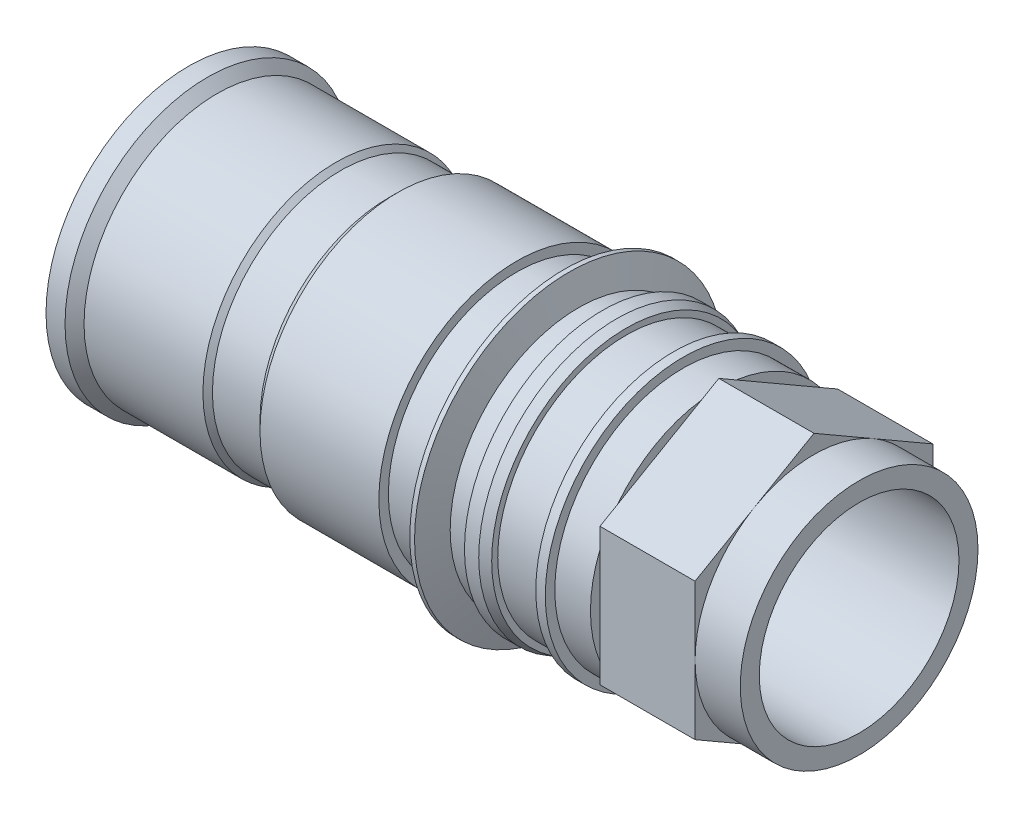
SolidWorks part; units mm, degrees
ref_plane "Alzado" through (0, 0, 0) normal (0, 0, 1) x (1, 0, 0)
ref_plane "Planta" through (0, 0, 0) normal (0, 1, 0) x (1, 0, 0)
ref_plane "Vista lateral" through (0, 0, 0) normal (1, 0, 0) x (0, 0, -1)
sketch "Croquis1" plane through (0, 0, 0) normal (0, 0, 1) x (1, 0, 0)
  line L0 (0, 0) -> (150.0259, 0) construction
  line L1 (0, 0) -> (0, 30)
  line L2 (0, 30) -> (4, 30)
  line L3 (4, 30) -> (6, 28)
  line L4 (6, 28) -> (31, 28)
  line L5 (31, 28) -> (32, 27)
  line L6 (32, 27) -> (42, 27)
  line L7 (42, 27) -> (44, 29)
  line L8 (44, 29) -> (69, 29)
  line L9 (69, 29) -> (69, 27)
  line L10 (69, 27) -> (77, 27)
  line L11 (77, 27) -> (79, 32.495)
  line L12 (79, 32.495) -> (80, 32.495)
  line L13 (80, 32.495) -> (82, 27)
  line L14 (82, 27) -> (87, 27)
  line L15 (87, 27) -> (87, 29)
  line L16 (87, 29) -> (90, 29)
  line L17 (90, 29) -> (92, 28.2721)
  line L18 (92, 28.2721) -> (92, 27)
  line L19 (92, 27) -> (102, 27)
  line L20 (102, 27) -> (102, 29)
  line L21 (102, 29) -> (104, 29)
  line L22 (104, 29) -> (104, 27)
  line L23 (104, 27) -> (111.5, 27)
  line L24 (111.5, 27) -> (111.5, 0)
  line L25 (111.5, 0) -> (0, 0)
  dimension "D1" = 111.5
  dimension "D2" = 60
  dimension "D3" = 4
  dimension "D4" = 135
  dimension "D5" = 2
  dimension "D6" = 25
  dimension "D7" = 1
  dimension "D8" = 10
  dimension "D9" = 2
  dimension "D10" = 25
  dimension "D11" = 2
  dimension "D12" = 8
  dimension "D13" = 2
  dimension "D14" = 110
  dimension "D15" = 1
  dimension "D16" = 2
  dimension "D17" = 5
  dimension "D18" = 2
  dimension "D19" = 3
  dimension "D20" = 10
  dimension "D21" = 2
  dimension "D22" = 2
revolve "Revolución1" add sketch "Croquis1" angle 360 about L0
sketch "Croquis2" plane through (111.5, 0, 0) normal (1, 0, 0) x (0, 0, -1)
  line L1 (0, 28.8675) -> (-25, 14.4338)
  line L2 (-25, 14.4338) -> (-25, -14.4338)
  line L3 (-25, -14.4338) -> (0, -28.8675)
  line L4 (0, -28.8675) -> (25, -14.4338)
  line L5 (25, -14.4338) -> (25, 14.4338)
  line L6 (25, 14.4338) -> (0, 28.8675)
  circle A0 centre (0, 0) radius 25 construction
  dimension "D1" = 50
extrude "Saliente-Extruir1" add sketch "Croquis2" along normal blind 20
sketch "Croquis3" plane through (131.5, 0, 0) normal (1, 0, 0) x (0, 0, -1)
  circle A0 centre (0, 0) radius 25
  dimension "D1" = 50
extrude "Saliente-Extruir2" add sketch "Croquis3" along normal blind 9.5
sketch "Croquis4" plane through (141, 0, 0) normal (1, 0, 0) x (0, 0, -1)
  circle A0 centre (0, 0) radius 21
  dimension "D1" = 42
extrude "Cortar-Extruir1" cut sketch "Croquis4" against normal through all
